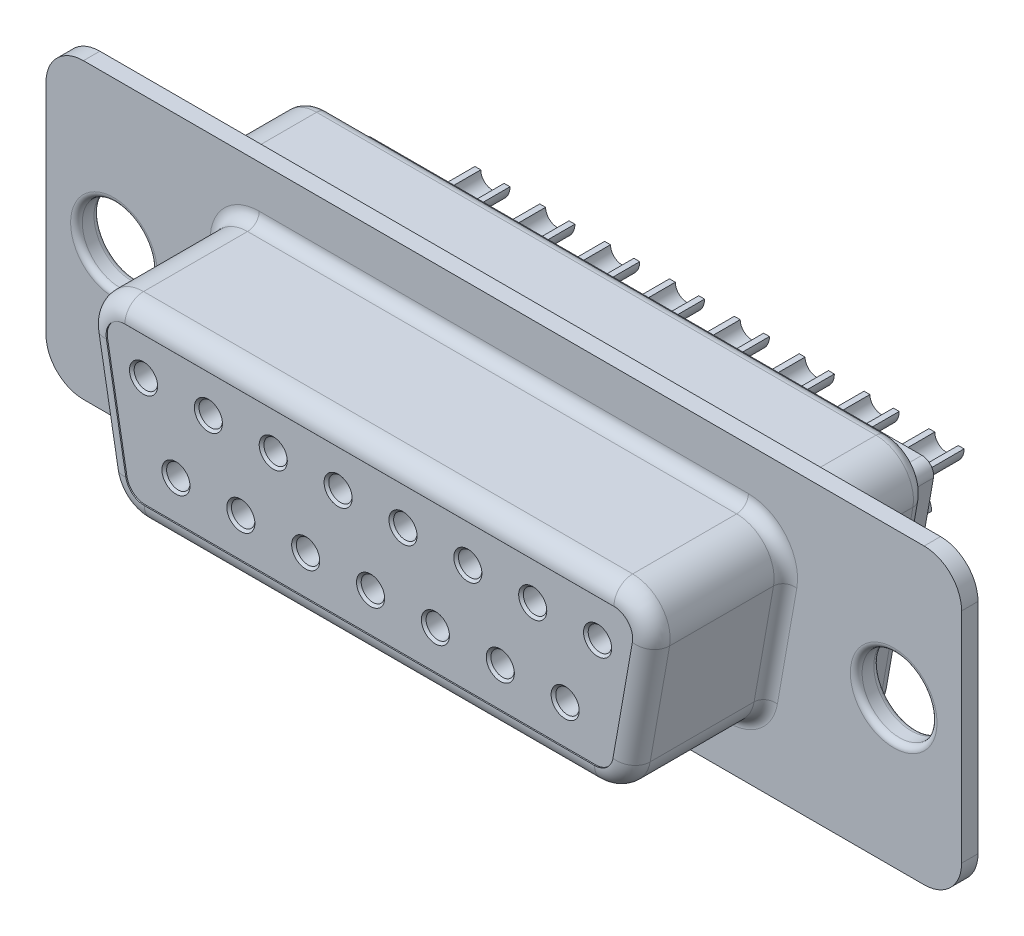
SolidWorks part; units mm, degrees
ref_plane "Front" through (0, 0, 0) normal (0, 0, 1) x (1, 0, 0)
ref_plane "Top" through (0, 0, 0) normal (0, 1, 0) x (1, 0, 0)
ref_plane "Right" through (0, 0, 0) normal (1, 0, 0) x (0, 0, -1)
sketch "Sketch1" plane through (0, 0, 0) normal (0, 0, 1) x (1, 0, 0)
  line L0 (0, 15.7999) -> (0, -16.2156) construction
  line L1 (-17.95, 6.265) -> (17.95, 6.265)
  line L2 (-19.55, 4.665) -> (-19.55, -4.665)
  line L3 (-17.95, -6.265) -> (17.95, -6.265)
  line L4 (19.55, 4.665) -> (19.55, -4.665)
  line L5 (-25.5708, 0) -> (26.8182, 0) construction
  arc A0 (17.95, 6.265) -> (19.55, 4.665) centre (17.95, 4.665) cw
  arc A1 (17.95, -6.265) -> (19.55, -4.665) centre (17.95, -4.665) ccw
  arc A2 (-19.55, -4.665) -> (-17.95, -6.265) centre (-17.95, -4.665) ccw
  arc A3 (-17.95, 6.265) -> (-19.55, 4.665) centre (-17.95, 4.665) ccw
  point P10 (19.55, 6.265)
  point P13 (19.55, -6.265)
  point P18 (-19.55, 6.265)
  dimension "D5" = 1.6
  dimension "D1" = 39.1
  dimension "D2" = 19.55
  dimension "D3" = 12.53
  dimension "D4" = 6.265
extrude "Extrude1" add sketch "Sketch1" against normal blind 0.7
sketch "Sketch2" plane through (0, 0, 0) normal (0, 0, 1) x (1, 0, 0)
  line L0 (0, -11.2848) -> (0, 18.2623) construction
  circle A0 centre (16.65, 0) radius 1.6
  circle A1 centre (-16.65, 0) radius 1.6
  dimension "D1" = 3.2
  dimension "D2" = 16.65
extrude "Cut-Extrude1" cut sketch "Sketch2" against normal through all
sketch "Sketch3" plane through (0, 0, 0) normal (0, 0, 1) x (1, 0, 0)
  line L0 (-10.4432, 3.95) -> (10.4432, 3.95)
  line L1 (-9.6145, -3.95) -> (9.6145, -3.95)
  line L2 (0, 11.4353) -> (0, -12.3443) construction
  line L3 (12.0189, 2.0722) -> (11.1901, -2.6278)
  line L4 (-12.0189, 2.0722) -> (-11.1901, -2.6278)
  arc A0 (10.4432, 3.95) -> (12.0189, 2.0722) centre (10.4432, 2.35) cw
  arc A1 (-12.0189, 2.0722) -> (-10.4432, 3.95) centre (-10.4432, 2.35) cw
  arc A2 (-9.6145, -3.95) -> (-11.1901, -2.6278) centre (-9.6145, -2.35) cw
  arc A3 (11.1901, -2.6278) -> (9.6145, -3.95) centre (9.6145, -2.35) cw
  dimension "D1" = 1.6
  dimension "D2" = 20.8864
  dimension "D4" = 19.2289
  dimension "D7" = 9.6145
  dimension "D3" = 10
  dimension "D5" = 3.95
  dimension "D6" = 7.9
extrude "Extrude2" add sketch "Sketch3" along normal blind 5.74
fillet "Fillet1" radius 0.8 8 edges at (11.6045, -0.2778, 5.74) (10.6429, -3.5757, 5.74) (0, -3.95, 5.74) (-10.6429, -3.5757, 5.74) (-11.6045, -0.2778, 5.74) (-11.6689, 3.3785, 5.74) (0, 3.95, 5.74) (11.6689, 3.3785, 5.74)
sketch "Sketch4" plane through (0, 0, 5.74) normal (0, 0, 1) x (1, 0, 0)
  line L4 (10.4023, -2.4889) -> (11.231, 2.2111)
  line L5 (10.4432, 3.15) -> (-10.4432, 3.15)
  line L6 (-11.231, 2.2111) -> (-10.4023, -2.4889)
  line L7 (-9.6145, -3.15) -> (9.6145, -3.15)
  line L8 (10.4023, -2.4889) -> (11.231, 2.2111)
  line L9 (10.4432, 3.15) -> (-10.4432, 3.15)
  line L10 (-11.231, 2.2111) -> (-10.4023, -2.4889)
  line L11 (-9.6145, -3.15) -> (9.6145, -3.15)
  arc A4 (9.6145, -3.15) -> (10.4023, -2.4889) centre (9.6145, -2.35) ccw
  arc A5 (11.231, 2.2111) -> (10.4432, 3.15) centre (10.4432, 2.35) ccw
  arc A6 (-10.4432, 3.15) -> (-11.231, 2.2111) centre (-10.4432, 2.35) ccw
  arc A7 (-10.4023, -2.4889) -> (-9.6145, -3.15) centre (-9.6145, -2.35) ccw
  arc A8 (9.6145, -3.15) -> (10.4023, -2.4889) centre (9.6145, -2.35) ccw
  arc A9 (11.231, 2.2111) -> (10.4432, 3.15) centre (10.4432, 2.35) ccw
  arc A10 (-10.4432, 3.15) -> (-11.231, 2.2111) centre (-10.4432, 2.35) ccw
  arc A11 (-10.4023, -2.4889) -> (-9.6145, -3.15) centre (-9.6145, -2.35) ccw
  dimension "D1" = 0
extrude "Cut-Extrude2" cut sketch "Sketch4" against normal blind 0.05
sketch "Sketch5" plane through (0, 0, 5.69) normal (0, 0, 1) x (1, 0, 0)
  line L0 (0, 7.7989) -> (0, -8.8516) construction
  line L1 (-16.65, 0) -> (16.65, 0) construction
  line L2 (0, -1.5) -> (2.77, -1.5) construction
  line L3 (0, -1.5) -> (-2.77, -1.5) construction
  line L4 (1.385, 1.5) -> (4.155, 1.5) construction
  line L5 (1.385, 1.5) -> (-1.385, 1.5) construction
  circle A0 centre (0, -1.5) radius 0.5
  circle A1 centre (2.77, -1.5) radius 0.5
  circle A2 centre (5.54, -1.5) radius 0.5
  circle A3 centre (8.31, -1.5) radius 0.5
  circle A4 centre (-2.77, -1.5) radius 0.5
  circle A5 centre (0, -1.5) radius 0.5
  circle A6 centre (2.77, -1.5) radius 0.5
  circle A7 centre (5.54, -1.5) radius 0.5
  circle A8 centre (-5.54, -1.5) radius 0.5
  circle A9 centre (-2.77, -1.5) radius 0.5
  circle A10 centre (0, -1.5) radius 0.5
  circle A11 centre (2.77, -1.5) radius 0.5
  circle A12 centre (-8.31, -1.5) radius 0.5
  circle A13 centre (-5.54, -1.5) radius 0.5
  circle A14 centre (-2.77, -1.5) radius 0.5
  circle A15 centre (0, -1.5) radius 0.5
  circle A16 centre (1.385, 1.5) radius 0.5
  circle A17 centre (4.155, 1.5) radius 0.5
  circle A18 centre (6.925, 1.5) radius 0.5
  circle A19 centre (9.695, 1.5) radius 0.5
  circle A20 centre (-1.385, 1.5) radius 0.5
  circle A21 centre (1.385, 1.5) radius 0.5
  circle A22 centre (4.155, 1.5) radius 0.5
  circle A23 centre (6.925, 1.5) radius 0.5
  circle A24 centre (-4.155, 1.5) radius 0.5
  circle A25 centre (-1.385, 1.5) radius 0.5
  circle A26 centre (1.385, 1.5) radius 0.5
  circle A27 centre (4.155, 1.5) radius 0.5
  circle A28 centre (-6.925, 1.5) radius 0.5
  circle A29 centre (-4.155, 1.5) radius 0.5
  circle A30 centre (-1.385, 1.5) radius 0.5
  circle A31 centre (1.385, 1.5) radius 0.5
  circle A32 centre (-9.695, 1.5) radius 0.5
  circle A33 centre (-6.925, 1.5) radius 0.5
  circle A34 centre (-4.155, 1.5) radius 0.5
  circle A35 centre (-1.385, 1.5) radius 0.5
  dimension "D1" = 1
  dimension "D2" = 1.5
  dimension "D3" = 1.385
  dimension "D4" = 1.5
extrude "Cut-Extrude3" cut sketch "Sketch5" against normal up to surface (5.69 mm away) contours A32 | A28 | A24 | A20 | A16 | A17 | A18 | A19 | A12 | A8 | A4 | A0 | A1 | A2 | A3
chamfer "Chamfer1" distance 0.1 angle 45 15 edges at (-7.81, -1.5, 5.69) (-5.04, -1.5, 5.69) (-2.27, -1.5, 5.69) (0.5, -1.5, 5.69) (3.27, -1.5, 5.69) (6.04, -1.5, 5.69) (8.81, -1.5, 5.69) (10.195, 1.5, 5.69) (7.425, 1.5, 5.69) (4.655, 1.5, 5.69) (1.885, 1.5, 5.69) (-0.885, 1.5, 5.69) (-3.655, 1.5, 5.69) (-6.425, 1.5, 5.69) (-9.195, 1.5, 5.69)
sketch "Sketch6" plane through (0, 0, -0.7) normal (0, 0, -1) x (-1, 0, 0)
  line L0 (0, 8.0382) -> (0, -10.1913) construction
  line L1 (-16.65, 0) -> (16.65, 0) construction
  line L2 (-11.7441, 3.46) -> (11.7441, 3.46)
  line L4 (-11.9432, 5.385) -> (11.9432, 5.385)
  line L5 (13.5189, 3.5072) -> (12.1841, -4.0628)
  line L6 (-10.6084, -5.385) -> (10.6084, -5.385)
  line L7 (-13.5189, 3.5072) -> (-12.1841, -4.0628)
  line L8 (-10.7003, -3.46) -> (10.7003, -3.46)
  line L10 (12.2365, 2.8732) -> (11.1927, -3.0468)
  line L11 (-12.2365, 2.8732) -> (-11.1927, -3.0468)
  arc A0 (-11.9432, 5.385) -> (-13.5189, 3.5072) centre (-11.9432, 3.785) ccw
  arc A1 (13.5189, 3.5072) -> (11.9432, 5.385) centre (11.9432, 3.785) ccw
  arc A2 (10.6084, -5.385) -> (12.1841, -4.0628) centre (10.6084, -3.785) ccw
  arc A3 (-12.1841, -4.0628) -> (-10.6084, -5.385) centre (-10.6084, -3.785) ccw
  arc A4 (11.7441, 3.46) -> (12.2365, 2.8732) centre (11.7441, 2.96) cw
  arc A5 (-11.7441, 3.46) -> (-12.2365, 2.8732) centre (-11.7441, 2.96) ccw
  arc A6 (-10.7003, -3.46) -> (-11.1927, -3.0468) centre (-10.7003, -2.96) cw
  arc A7 (11.1927, -3.0468) -> (10.7003, -3.46) centre (10.7003, -2.96) cw
  dimension "D1" = 1.6
  dimension "D6" = 11.9432
  dimension "D7" = 11.9432
  dimension "D10" = 0.5
  dimension "D3" = 5.385
  dimension "D4" = 10
  dimension "D2" = 10.77
  dimension "D5" = 20
  dimension "D8" = 1.925
extrude "Extrude3" add sketch "Sketch6" along normal blind 3.75
fillet "Fillet2" radius 0.5 8 edges at (-13.1689, 4.8135, -4.45) (-12.8515, -0.2778, -4.45) (-11.6369, -5.0107, -4.45) (0, -5.385, -4.45) (11.6369, -5.0107, -4.45) (12.8515, -0.2778, -4.45) (13.1689, 4.8135, -4.45) (0, 5.385, -4.45)
sketch "Sketch7" plane through (0, 0, -0.7) normal (0, 0, -1) x (-1, 0, 0)
  line L4 (11.7441, 3.46) -> (-11.7441, 3.46)
  line L5 (-12.2365, 2.8732) -> (-11.1927, -3.0468)
  line L6 (-10.7003, -3.46) -> (10.7003, -3.46)
  line L7 (11.1927, -3.0468) -> (12.2365, 2.8732)
  line L8 (11.7441, 3.46) -> (-11.7441, 3.46)
  line L9 (-12.2365, 2.8732) -> (-11.1927, -3.0468)
  line L10 (-10.7003, -3.46) -> (10.7003, -3.46)
  line L11 (11.1927, -3.0468) -> (12.2365, 2.8732)
  arc A4 (12.2365, 2.8732) -> (11.7441, 3.46) centre (11.7441, 2.96) ccw
  arc A5 (-11.7441, 3.46) -> (-12.2365, 2.8732) centre (-11.7441, 2.96) ccw
  arc A6 (-11.1927, -3.0468) -> (-10.7003, -3.46) centre (-10.7003, -2.96) ccw
  arc A7 (10.7003, -3.46) -> (11.1927, -3.0468) centre (10.7003, -2.96) ccw
  arc A8 (12.2365, 2.8732) -> (11.7441, 3.46) centre (11.7441, 2.96) ccw
  arc A9 (-11.7441, 3.46) -> (-12.2365, 2.8732) centre (-11.7441, 2.96) ccw
  arc A10 (-11.1927, -3.0468) -> (-10.7003, -3.46) centre (-10.7003, -2.96) ccw
  arc A11 (10.7003, -3.46) -> (11.1927, -3.0468) centre (10.7003, -2.96) ccw
  dimension "D1" = 0
extrude "Extrude4" add sketch "Sketch7" along normal blind 5.41
sketch "Sketch8" plane through (0, 0, -6.11) normal (0, 0, -1) x (-1, 0, 0)
  line L0 (0, 8.7559) -> (0, -8.5166) construction
  line L1 (-16.65, 0) -> (16.65, 0) construction
  line L2 (1.385, 1.5) -> (4.155, 1.5) construction
  line L3 (1.385, 1.5) -> (-1.385, 1.5) construction
  line L4 (0, -1.5) -> (2.77, -1.5) construction
  line L5 (0, -1.5) -> (-2.77, -1.5) construction
  circle A0 centre (0, -1.5) radius 0.75
  circle A1 centre (1.385, 1.5) radius 0.75
  circle A2 centre (4.155, 1.5) radius 0.75
  circle A3 centre (6.925, 1.5) radius 0.75
  circle A4 centre (9.695, 1.5) radius 0.75
  circle A5 centre (-1.385, 1.5) radius 0.75
  circle A6 centre (1.385, 1.5) radius 0.75
  circle A7 centre (4.155, 1.5) radius 0.75
  circle A8 centre (6.925, 1.5) radius 0.75
  circle A9 centre (-4.155, 1.5) radius 0.75
  circle A10 centre (-1.385, 1.5) radius 0.75
  circle A11 centre (1.385, 1.5) radius 0.75
  circle A12 centre (4.155, 1.5) radius 0.75
  circle A13 centre (-6.925, 1.5) radius 0.75
  circle A14 centre (-4.155, 1.5) radius 0.75
  circle A15 centre (-1.385, 1.5) radius 0.75
  circle A16 centre (1.385, 1.5) radius 0.75
  circle A17 centre (-9.695, 1.5) radius 0.75
  circle A18 centre (-6.925, 1.5) radius 0.75
  circle A19 centre (-4.155, 1.5) radius 0.75
  circle A20 centre (-1.385, 1.5) radius 0.75
  circle A21 centre (2.77, -1.5) radius 0.75
  circle A22 centre (5.54, -1.5) radius 0.75
  circle A23 centre (8.31, -1.5) radius 0.75
  circle A24 centre (-2.77, -1.5) radius 0.75
  circle A25 centre (0, -1.5) radius 0.75
  circle A26 centre (2.77, -1.5) radius 0.75
  circle A27 centre (5.54, -1.5) radius 0.75
  circle A28 centre (-5.54, -1.5) radius 0.75
  circle A29 centre (-2.77, -1.5) radius 0.75
  circle A30 centre (0, -1.5) radius 0.75
  circle A31 centre (2.77, -1.5) radius 0.75
  circle A32 centre (-8.31, -1.5) radius 0.75
  circle A33 centre (-5.54, -1.5) radius 0.75
  circle A34 centre (-2.77, -1.5) radius 0.75
  circle A35 centre (0, -1.5) radius 0.75
  dimension "D1" = 1.5
  dimension "D2" = 1.5
  dimension "D3" = 1.5
  dimension "D4" = 1.385
extrude "Extrude5" add sketch "Sketch8" along normal blind 3.1 contours A17 | A13 | A9 | A5 | A1 | A2 | A3 | A4 | A32 | A28 | A24 | A0 | A21 | A22 | A23
ref_plane "Plane1" through (0, 1.5, 0) normal (0, 1, 0) x (-1, 0, 0)
ref_plane "Plane2" through (0, -1.5, 0) normal (0, 1, 0) x (-1, 0, 0)
sketch "Sketch9" plane through (0, 1.5, 0) normal (0, 1, 0) x (-1, 0, 0)
  line L0 (-10.445, -9.21) -> (-8.945, -9.21) construction
  line L1 (-10.445, -9.21) -> (10.445, -9.21)
  line L2 (-10.445, -9.21) -> (-10.445, -7.21)
  line L3 (-10.445, -7.21) -> (10.445, -7.21)
  line L4 (10.445, -9.21) -> (10.445, -7.21)
  line L5 (10.445, -9.21) -> (10.445, -6.11) construction
  line L6 (-10.445, -6.11) -> (-10.445, -9.21) construction
  dimension "D1" = 2
extrude "Cut-Extrude4" cut sketch "Sketch9" along normal blind 3.1
sketch "Sketch10" plane through (0, -1.5, 0) normal (0, 1, 0) x (-1, 0, 0)
  line L1 (-10.445, -9.21) -> (10.445, -9.21)
  line L2 (-10.445, -9.21) -> (-10.445, -7.21)
  line L3 (-10.445, -7.21) -> (10.445, -7.21)
  line L4 (10.445, -9.21) -> (10.445, -7.21)
extrude "Cut-Extrude5" cut sketch "Sketch10" against normal blind 3.1
sketch "Sketch11" plane through (0, 0, -9.21) normal (0, 0, -1) x (-1, 0, 0)
  circle A0 centre (-9.695, 1.5) radius 0.5
  circle A1 centre (-6.925, 1.5) radius 0.5
  circle A2 centre (-4.155, 1.5) radius 0.5
  circle A3 centre (-1.385, 1.5) radius 0.5
  circle A4 centre (1.385, 1.5) radius 0.5
  circle A5 centre (4.155, 1.5) radius 0.5
  circle A6 centre (6.925, 1.5) radius 0.5
  circle A7 centre (9.695, 1.5) radius 0.5
  circle A8 centre (-8.31, -1.5) radius 0.5
  circle A9 centre (-5.54, -1.5) radius 0.5
  circle A10 centre (-2.77, -1.5) radius 0.5
  circle A11 centre (0, -1.5) radius 0.5
  circle A12 centre (2.77, -1.5) radius 0.5
  circle A13 centre (5.54, -1.5) radius 0.5
  circle A14 centre (8.31, -1.5) radius 0.5
  dimension "D1" = 1
extrude "Cut-Extrude6" cut sketch "Sketch11" against normal up to surface (4.76 mm away)
fillet "Fillet3" radius 0.25 2 edges at (-18.25, 0, 0) (18.25, 0, 0)
sketch "Sketch12" plane through (0, 0, -0.7) normal (0, 0, -1) x (-1, 0, 0)
  circle A0 centre (16.65, 0) radius 1.6 construction
  circle A1 centre (-16.65, 0) radius 1.6 construction
  circle A2 centre (16.65, 0) radius 1.6
  circle A3 centre (-16.65, 0) radius 1.6
  circle A4 centre (-16.65, 0) radius 2.15
  circle A5 centre (16.65, 0) radius 2.15
  dimension "D1" = 4.3
extrude "Extrude6" add sketch "Sketch12" along normal blind 0.3
fillet "Fillet4" radius 0.25 2 edges at (-18.25, 0, -1) (15.05, 0, -1)
fillet "Fillet5" radius 0.5 8 edges at (11.6689, 3.3785, 0) (11.6045, -0.2778, 0) (10.6429, -3.5757, 0) (0, -3.95, 0) (-10.6429, -3.5757, 0) (-11.6045, -0.2778, 0) (-11.6689, 3.3785, 0) (0, 3.95, 0)
fillet "Fillet6" radius 0.5 8 edges at (-13.1689, 4.8135, -0.7) (-12.8515, -0.2778, -0.7) (-11.6369, -5.0107, -0.7) (0, -5.385, -0.7) (11.6369, -5.0107, -0.7) (12.8515, -0.2778, -0.7) (13.1689, 4.8135, -0.7) (0, 5.385, -0.7)
equation "\"D2@Sketch1\" = \"D1@Sketch1\"/2"
equation "\"D4@Sketch1\" =  \"D3@Sketch1\"/2"
equation "\"D7@Sketch3\" = \"D4@Sketch3\"/2"
equation "\"D7@Sketch6\" = \"D6@Sketch6\""
